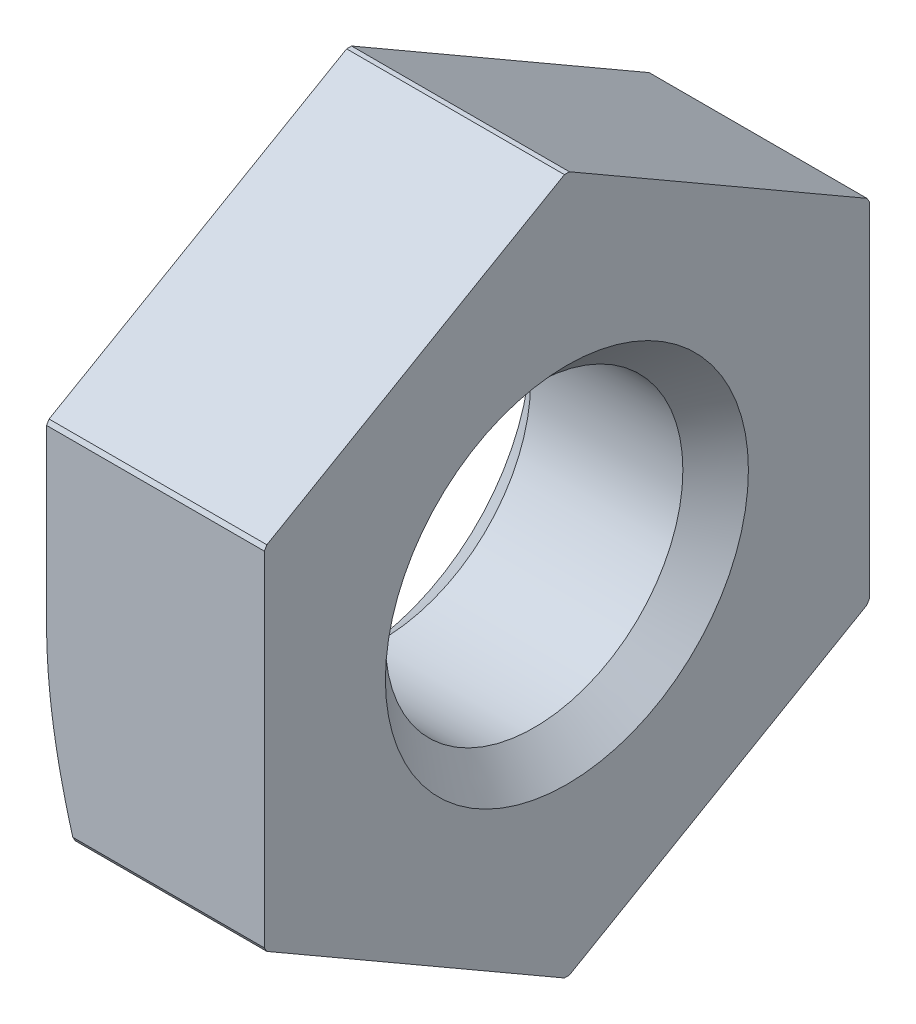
SolidWorks part; units mm, degrees
ref_plane "Front Plane" through (0, 0, 0) normal (0, 0, 1) x (1, 0, 0)
ref_plane "Top Plane" through (0, 0, 0) normal (0, 1, 0) x (1, 0, 0)
ref_plane "Right Plane" through (0, 0, 0) normal (1, 0, 0) x (0, 0, -1)
ref_plane "Plane1" through (2.5, 0, 0) normal (1, 0, 0) x (0, 0, -1)
sketch "Sketch1" plane through (2.5, 0, 0) normal (1, 0, 0) x (0, 0, -1)
  line L0 (-5, 2.8395) -> (-5, -2.8395)
  line L1 (-4.959, -2.9104) -> (-0.041, -5.7499)
  line L2 (0.041, -5.7499) -> (4.959, -2.9104)
  line L3 (5, -2.8395) -> (5, 2.8395)
  line L4 (4.959, 2.9104) -> (0.041, 5.7499)
  line L5 (-0.041, 5.7499) -> (-4.959, 2.9104)
  arc A0 (-5, -2.8395) -> (-4.959, -2.9104) centre (0, 0) ccw
  arc A1 (-0.041, -5.7499) -> (0.041, -5.7499) centre (0, 0) ccw
  arc A2 (4.959, -2.9104) -> (5, -2.8395) centre (0, 0) ccw
  arc A3 (5, 2.8395) -> (4.959, 2.9104) centre (0, 0) ccw
  arc A4 (0.041, 5.7499) -> (-0.041, 5.7499) centre (0, 0) ccw
  arc A5 (-4.959, 2.9104) -> (-5, 2.8395) centre (0, 0) ccw
extrude "Boss-Extrude1" add sketch "Sketch1" against normal blind 3.6
hole_wizard "Hole1" positions "Sketch3" profile "Sketch2" legacy
sketch "Sketch3" plane through (2.5, 0, 0) normal (1, 0, 0) x (0, 0, -1)
  point P0 (0, 0)
sketch "Sketch2" plane through (2.5, 0, 0) normal (0, 1, 0) x (0, 0, -1)
  line L0 (0, 0) -> (0, 3.6)
  line L1 (0, 3.6) -> (2.4585, 3.6)
  line L2 (2.4585, 3.6) -> (2.4585, 0)
  line L3 (2.4585, 0) -> (0, 0)
  line L4 (0, 110) -> (0, -10) construction
  dimension "Diameter" = 4.917
  dimension "Depth" = 3.6
chamfer "Chamfer2" distance 0.5415 angle 45 2 edges at (-1.1, 0, -2.4585) (2.5, 0, -2.4585)
chamfer "Chamfer3" distance 0.75 angle 30 1 edges at (-1.1, -2.875, 4.9796)
